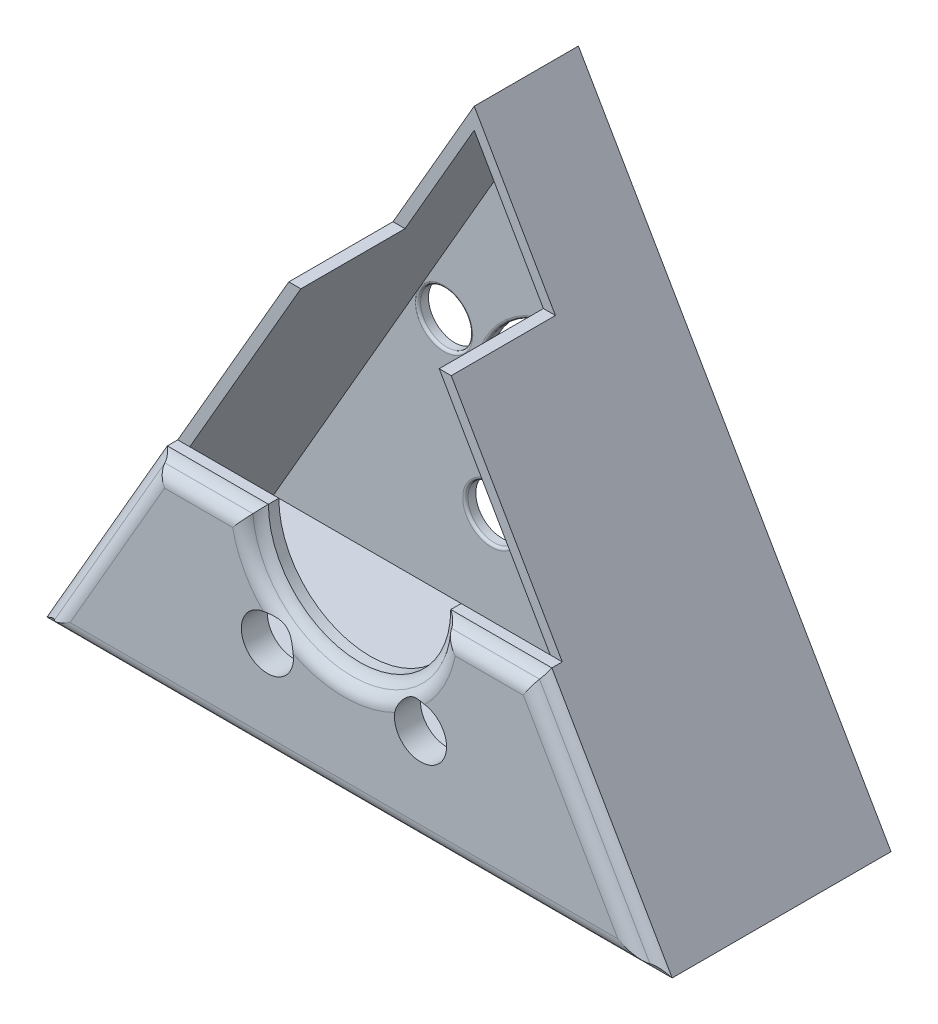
SolidWorks part; units mm, degrees
ref_plane "Alzado" through (0, 0, 0) normal (0, 0, 1) x (1, 0, 0)
ref_plane "Planta" through (0, 0, 0) normal (0, 1, 0) x (1, 0, 0)
ref_plane "Vista lateral" through (0, 0, 0) normal (1, 0, 0) x (0, 0, -1)
sketch "Croquis1" plane through (0, 0, 0) normal (0, 0, 1) x (1, 0, 0)
  line L0 (0, 0) -> (120, 0)
  line L1 (120, 0) -> (60.0002, 103.9229)
  line L2 (0, 0) -> (60.0002, 103.9229)
  dimension "D1" = 120
  dimension "D3" = 120
  dimension "D4" = 60
extrude "Saliente-Extruir1" add sketch "Croquis1" along normal blind 40
shell "Vaciado1" thickness 2
sketch "Croquis2" plane through (0, 0, 40) normal (0, 0, 1) x (1, 0, 0)
  line L0 (0, 0) -> (120, 0)
  line L1 (120, 0) -> (96.906, 40)
  line L2 (120, 0) -> (60.0002, 103.9229) construction
  line L3 (96.906, 40) -> (23.0941, 40)
  line L5 (23.0941, 40) -> (0, 0)
  line L6 (60.0002, 103.9229) -> (0, 0) construction
  dimension "D1" = 60
  dimension "D2" = 60
  dimension "D3" = 40
extrude "Saliente-Extruir2" add sketch "Croquis2" along normal blind 2
sketch "Croquis4" plane through (0, 0, 40) normal (0, 0, 1) x (1, 0, 0)
  line L0 (96.906, 40) -> (60.0002, 103.9229) construction
  line L1 (75.5885, 76.923) -> (44.4116, 76.923)
  line L2 (75.5885, 76.923) -> (75.5885, 103.9229)
  line L3 (75.5885, 103.9229) -> (44.4116, 103.9229)
  line L4 (44.4116, 76.923) -> (44.4116, 103.9229)
  line L5 (0, 0) -> (120, 0) construction
  point P11 (55.8536, 0)
  dimension "D1" = 76.923
  dimension "D2" = 31.1769
extrude "Cortar-Extruir1" cut sketch "Croquis4" against normal blind 20
sketch "Croquis6" plane through (0, 0, 0) normal (0, 0, -1) x (-1, 0, 0)
  line L0 (-94.5966, 40) -> (-25.4035, 40) construction
  circle A0 centre (-60.0001, 40) radius 17.5
  dimension "D1" = 35
extrude "Cortar-Extruir2" cut sketch "Croquis6" against normal through all
sketch "Croquis7" plane through (0, 0, 0) normal (0, 0, -1) x (-1, 0, 0)
  circle A0 centre (-60.0002, 65) radius 5
  circle A1 centre (-60.0001, 40) radius 17.5 construction
  point P18 (-60, 40)
  dimension "D1" = 10
  dimension "D2" = 25
extrude "Cortar-Extruir3" cut sketch "Croquis7" against normal up to next
pattern_circular "MatrizC1" count 5 over 360 about axis through (60.0001, 40, 0) along (0, 0, 1) of "Cortar-Extruir3"
sketch "Croquis10" plane through (0, 0, 42) normal (0, 0, 1) x (1, 0, 0)
  circle A0 centre (45.3054, 19.7746) radius 5
  circle A2 centre (74.6946, 19.7745) radius 5
  circle A6 centre (45.3054, 19.7746) radius 5 construction
  circle A9 centre (74.6946, 19.7745) radius 5 construction
  dimension "D1" = 10
extrude "Cortar-Extruir4" cut sketch "Croquis10" against normal up to next
sketch "Croquis11" plane through (0, 0, 42) normal (0, 0, 1) x (1, 0, 0)
  line L10 (42.5001, 40) -> (23.0941, 40)
  line L11 (23.0941, 40) -> (0, 0)
  line L12 (0, 0) -> (120, 0)
  line L13 (120, 0) -> (96.906, 40)
  line L14 (96.906, 40) -> (77.5001, 40)
  line L15 (42.5001, 40) -> (23.0941, 40)
  line L16 (23.0941, 40) -> (0, 0)
  line L17 (0, 0) -> (120, 0)
  line L18 (120, 0) -> (96.906, 40)
  line L19 (96.906, 40) -> (77.5001, 40)
  line L25 (40.6029, 38) -> (24.2488, 38)
  line L26 (24.2488, 38) -> (3.4641, 2)
  line L27 (3.4641, 2) -> (116.5359, 2)
  line L28 (116.5359, 2) -> (95.7513, 38)
  line L29 (95.7513, 38) -> (79.3972, 38)
  line L30 (40.6029, 38) -> (24.2488, 38)
  line L31 (24.2488, 38) -> (3.4641, 2)
  line L32 (3.4641, 2) -> (116.5359, 2)
  line L33 (116.5359, 2) -> (95.7513, 38)
  line L34 (95.7513, 38) -> (79.3972, 38)
  arc A2 (42.5001, 40) -> (77.5001, 40) centre (60.0001, 40) ccw
  arc A3 (42.5001, 40) -> (77.5001, 40) centre (60.0001, 40) ccw
  arc A5 (40.6029, 38) -> (79.3972, 38) centre (60.0001, 40) ccw
  arc A6 (40.6029, 38) -> (79.3972, 38) centre (60.0001, 40) ccw
  dimension "D1" = 0
  dimension "D2" = 2
extrude "Saliente-Extruir5" add sketch "Croquis11" along normal blind 3 contours A6 L30 L31 L32 L33 L34 M14 M13
fillet "Redondeo1" radius 3 6 edges at (106.1436, 20, 42) (13.8565, 20, 42) (60, 2, 42) (60.0001, 20.5, 42) (87.5743, 38, 42) (32.4259, 38, 42)
fillet "Redondeo2" radius 3 6 edges at (13.8565, 20, 45) (60, 2, 45) (106.1436, 20, 45) (87.5743, 38, 45) (60.0001, 20.5, 45) (32.4259, 38, 45)
fillet "Redondeo3" radius 0.5 6 edges at (77.5001, 40, 2) (88.7765, 47.7253, 2) (79.6946, 19.7745, 2) (50.3054, 19.7746, 2) (41.2237, 47.7255, 2) (65.0002, 65, 2)
